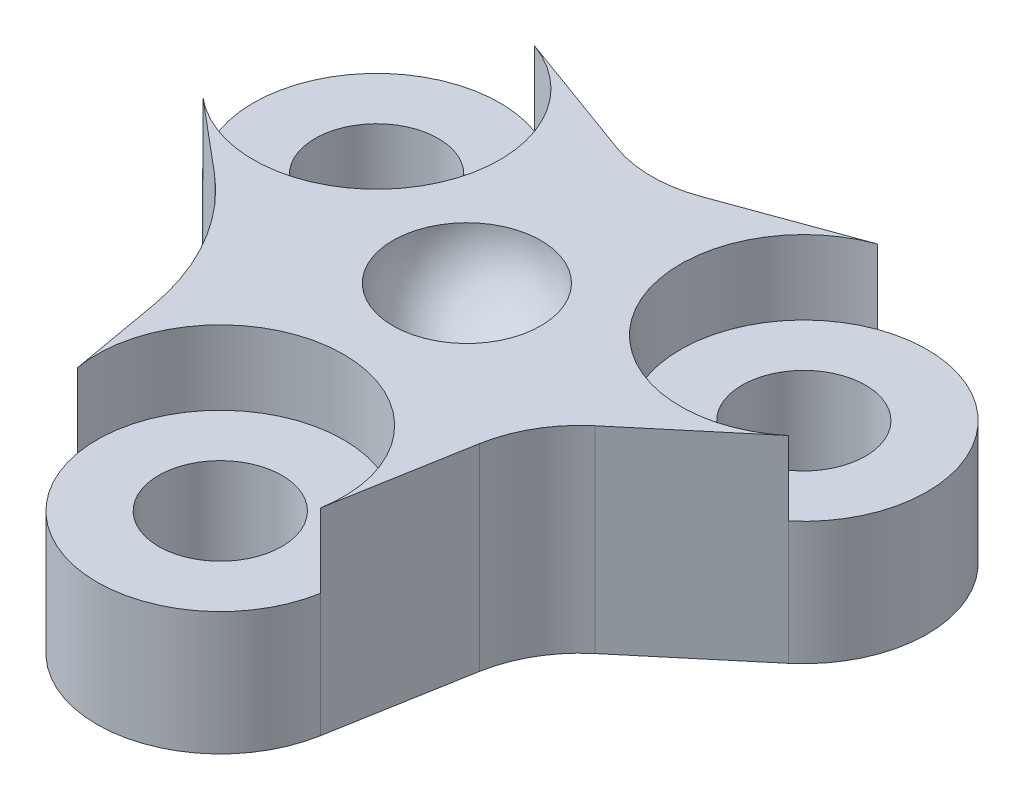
SolidWorks part; units mm, degrees
ref_plane "Front Plane" through (0, 0, 0) normal (0, 0, 1) x (1, 0, 0)
ref_plane "Top Plane" through (0, 0, 0) normal (0, 1, 0) x (1, 0, 0)
ref_plane "Right Plane" through (0, 0, 0) normal (1, 0, 0) x (0, 0, -1)
sketch "Sketch1" plane through (0, 0, 0) normal (0, 1, 0) x (1, 0, 0)
  line L0 (0, 15.0384) -> (0, -20.5281) construction
  line L1 (-21.1174, 0) -> (27.0859, 0) construction
  line L2 (0, 0) -> (19.7742, 11.4166) construction
  line L3 (0, 0) -> (-16.5858, 9.5758) construction
  line L4 (-4.924, -10.8682) -> (-5.5763, -7.1688)
  line L5 (4.924, -10.8682) -> (5.8924, -5.3766)
  line L6 (-11.8742, 1.1698) -> (-8.9965, -1.2449)
  line L7 (-6.9502, 9.6985) -> (-1.7101, 7.7912)
  line L8 (11.8742, 1.1698) -> (7.6025, -2.4146)
  line L9 (6.9502, 9.6985) -> (1.7101, 7.7912)
  line L10 (3.1703, -6.1336) -> (1.3566, -7.6555)
  arc A1 (11.8742, 1.1698) -> (6.9502, 9.6985) centre (8.6603, 5) ccw
  arc A2 (-4.924, -10.8682) -> (4.924, -10.8682) centre (0, -10) ccw
  arc A3 (-6.9502, 9.6985) -> (-11.8742, 1.1698) centre (-8.6603, 5) ccw
  arc A4 (-5.5763, -7.1688) -> (-8.9965, -1.2449) centre (-15.4244, -8.9053) ccw
  arc A5 (1.7101, 7.7912) -> (-1.7101, 7.7912) centre (0, 12.4897) cw
  arc A6 (5.8924, -5.3766) -> (7.6025, -2.4146) centre (10.8164, -6.2449) cw
  dimension "D2" = 10
  dimension "D4" = 30
  dimension "D5" = 10
  dimension "D8" = 10
  dimension "D13" = 10
  dimension "D14" = 5
  dimension "D15" = 5
  dimension "D3" = 10
  dimension "D6" = 10
  dimension "D7" = 30
  dimension "D9" = 10
  dimension "D10" = 20
  dimension "D11" = 20
  dimension "D12" = 20
extrude "Extrude1" add sketch "Sketch1" along normal blind 8 contours L4 A4 L6 A3 L7 A5 L9 A1 L8 A6 L5 A2
sketch "Sketch2" plane through (0, 8, 0) normal (0, 1, 0) x (1, 0, 0)
  circle A0 centre (-8.6603, 5) radius 5
  circle A1 centre (8.6603, 5) radius 5
  circle A2 centre (0, -10) radius 5
  dimension "D1" = 10
extrude "Cut-Extrude1" cut sketch "Sketch2" against normal blind 3
sketch "Sketch3" plane through (0, 5, 0) normal (0, 1, 0) x (1, 0, 0)
  circle A0 centre (0, -10) radius 2.5
  circle A1 centre (8.6603, 5) radius 2.5
  circle A2 centre (-8.6603, 5) radius 2.5
extrude "Cut-Extrude2" cut sketch "Sketch3" against normal through all
sketch "Sketch6" plane through (0, 8, 0) normal (0, 1, 0) x (1, 0, 0)
  line L0 (0, 9.6019) -> (0, -10.4009) construction
  line L1 (0, 3) -> (0, -3)
  arc A0 (0, -3) -> (0, 3) centre (0, 0) ccw
  dimension "D1" = 6
revolve "Cut-Revolve1" cut sketch "Sketch6" angle 360 about L0
